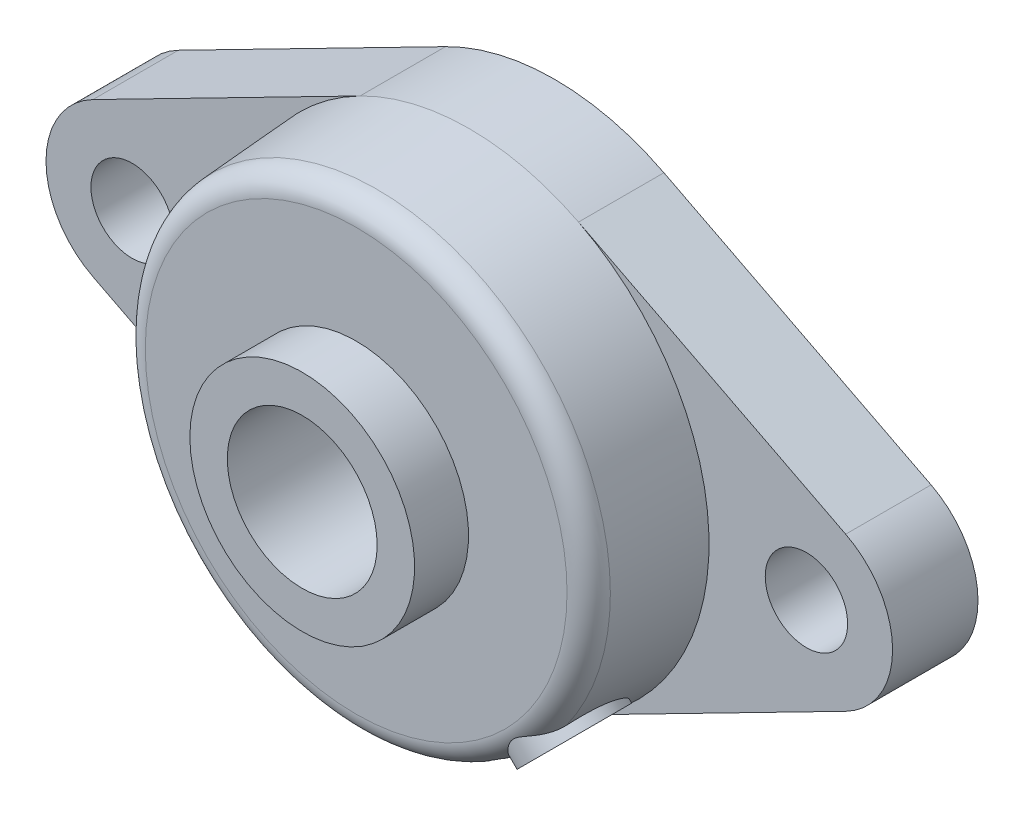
SolidWorks part; units mm, degrees
ref_plane "Plan de face" through (0, 0, 0) normal (0, 0, 1) x (1, 0, 0)
ref_plane "Plan de dessus" through (0, 0, 0) normal (0, 1, 0) x (1, 0, 0)
ref_plane "Plan de droite" through (0, 0, 0) normal (1, 0, 0) x (0, 0, -1)
sketch "Esquisse1" plane through (0, 0, 0) normal (0, 0, 1) x (1, 0, 0)
  line L0 (-50.2389, 10.2374) -> (-14.5778, 28.4866)
  line L1 (14.5778, 28.4866) -> (50.2389, 10.2374)
  line L2 (-50.2389, -10.2374) -> (-14.5778, -28.4866)
  line L3 (14.5778, -28.4866) -> (50.2389, -10.2374)
  arc A0 (14.5778, 28.4866) -> (-14.5778, 28.4866) centre (0, 0) ccw
  arc A1 (50.2389, -10.2374) -> (50.2389, 10.2374) centre (45, 0) ccw
  arc A2 (-50.2389, 10.2374) -> (-50.2389, -10.2374) centre (-45, 0) ccw
  arc A3 (-14.5778, -28.4866) -> (14.5778, -28.4866) centre (0, 0) ccw
  circle A4 centre (-45, 0) radius 5.5
  circle A5 centre (45, 0) radius 5.5
  dimension "D2" = 23
  dimension "D3" = 23
  dimension "D4" = 64
  dimension "D6" = 11
  dimension "D7" = 11
  dimension "D1" = 90
  dimension "D5" = 45
  dimension "D8" = 90
  dimension "D9" = 45
extrude "Extrusion1" add sketch "Esquisse1" along normal blind 11.4
sketch "Esquisse2" plane through (0, 0, 11.4) normal (0, 0, 1) x (1, 0, 0)
  circle A0 centre (0, 0) radius 32
  arc A1 (14.5778, 28.4866) -> (-14.5778, 28.4866) centre (0, 0) ccw construction
extrude "Extrusion2" add sketch "Esquisse2" along normal blind 15.1 draft 4
fillet "Congé1" radius 3 1 edges at (30.9441, 0, 26.5)
sketch "Esquisse7" plane through (0, 0, 0) normal (0, 0, -1) x (-1, 0, 0)
  circle A0 centre (0, 0) radius 26
  dimension "D1" = 52
extrude "Dégagement" cut sketch "Esquisse7" against normal blind 6
sketch "Esquisse3" plane through (0, 0, 26.5) normal (0, 0, 1) x (1, 0, 0)
  circle A0 centre (0, 0) radius 15
  dimension "D2" = 30
extrude "Extrusion3" add sketch "Esquisse3" along normal blind 7.2 and the other way blind 23.8
ref_plane "Plan3" through (0, 0, 0) normal (-0.7071, 0.7071, 0) x (0, 0, 1)
sketch "Esquisse6" plane through (0, 0, 0) normal (-0.7071, 0.7071, 0) x (0, 0, 1)
  line L0 (0, -9.835) -> (0, 28.2853) construction
  line L1 (11.4, 0) -> (23.7093, 0) construction
  circle A0 centre (20, 0) radius 6.25
  dimension "D1" = 12.5
  dimension "D2" = 20
extrude "Extrusion4" add sketch "Esquisse6" against normal blind 32
sketch "Esquisse4" plane through (0, 0, 33.7) normal (0, 0, 1) x (1, 0, 0)
  circle A0 centre (0, 0) radius 10
  dimension "D1" = 20
extrude "Enlèv. mat.-Extru.1" cut sketch "Esquisse4" against normal through all
